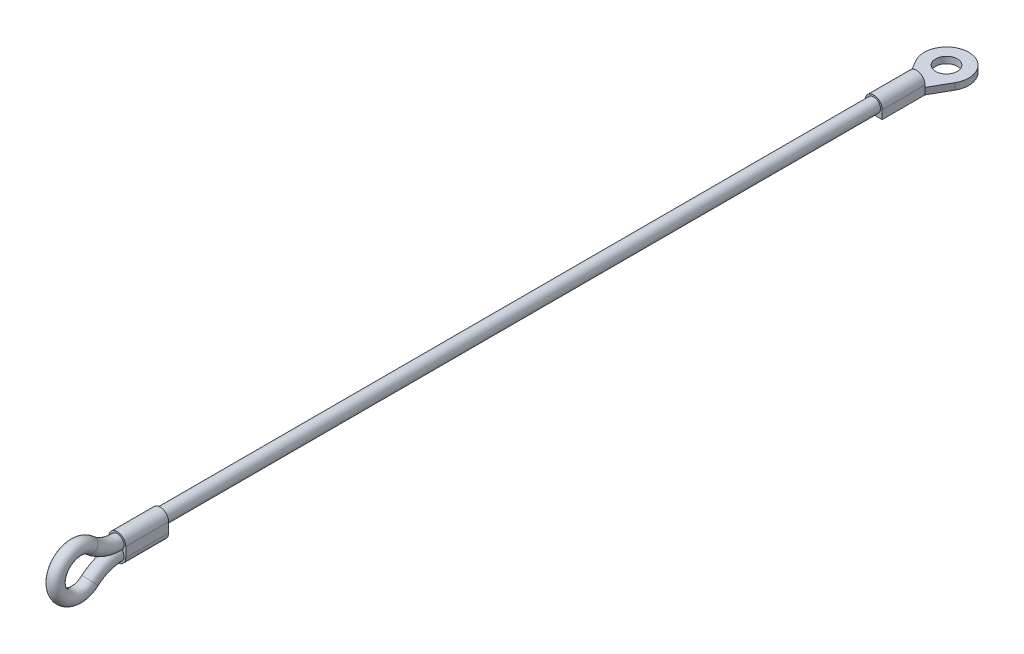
SolidWorks part; units mm, degrees
ref_plane "Front Plane" through (0, 0, 0) normal (0, 0, 1) x (1, 0, 0)
ref_plane "Top Plane" through (0, 0, 0) normal (0, 1, 0) x (1, 0, 0)
ref_plane "Right Plane" through (0, 0, 0) normal (1, 0, 0) x (0, 0, -1)
sketch "Sketch1" plane through (0, 0, 0) normal (1, 0, 0) x (0, 0, -1)
  line L2 (-176.6, 0) -> (0, 0)
  arc A0 (-176.6, 0) -> (-183, 2.4446) centre (-176.6, 9.6) cw
  arc A1 (-183, 2.4446) -> (-183, -4.7108) centre (-186.2, -1.1331) ccw
  arc A2 (-183, -4.7108) -> (-176.6, -2.2663) centre (-176.6, -11.8663) cw
  dimension "D1" = 4.8
  dimension "D4" = 9.6
  dimension "D2" = 186.2
  dimension "D3" = 9.6
sketch "Sketch2" plane through (0, 0, 0) normal (0, 0, 1) x (1, 0, 0)
  circle A0 centre (0, 0) radius 1.59
  dimension "D1" = 3.18
sweep "Sweep1" add profiles "Sketch2" path "Sketch1"
sketch "Sketch3" plane through (0, 0, 176.6) normal (0, 0, -1) x (-1, 0, 0)
  line L0 (0, 0) -> (0, -2.2663) construction
  line L1 (1.99, 0) -> (1.99, -2.2663)
  line L2 (-1.99, 0) -> (-1.99, -2.2663)
  line L3 (-1.59, -2.2663) -> (1.59, -2.2663) construction
  arc A0 (1.99, 0) -> (-1.99, 0) centre (0, 0) ccw
  arc A1 (-1.99, -2.2663) -> (1.99, -2.2663) centre (0, -2.2663) ccw
  point P3 (0, -1.1331)
  dimension "D1" = 3.98
extrude "Boss-Extrude1" add sketch "Sketch3" along normal blind 10
sketch "Sketch4" plane through (0, 0, 0) normal (0, 0, -1) x (-1, 0, 0)
  line L0 (-1.99, 0) -> (-1.99, -1.99)
  line L1 (-1.99, -1.99) -> (0, -1.99)
  line L2 (0, -1.99) -> (1.99, -1.99)
  line L3 (1.99, -1.99) -> (1.99, 0)
  arc A0 (1.99, 0) -> (-1.99, 0) centre (0, 0) ccw
  dimension "D1" = 3.98
extrude "Boss-Extrude2" add sketch "Sketch4" along normal blind 10
sketch "Sketch5" plane through (0, -1.99, 0) normal (0, -1, 0) x (1, 0, 0)
  line L0 (-1.99, -10) -> (1.99, -10)
  line L1 (1.99, -10) -> (4.5171, -14.4138)
  line L2 (-4.5171, -14.4138) -> (-1.99, -10)
  arc A0 (4.5171, -14.4138) -> (-4.5171, -14.4138) centre (0, -17) cw
  circle A1 centre (0, -17) radius 2.54
  point P8 (-5.205, -17)
  point P9 (5.205, -17)
  dimension "D1" = 5.08
  dimension "D2" = 10.41
  dimension "D3" = 17
extrude "Boss-Extrude3" add sketch "Sketch5" against normal blind 1.52
